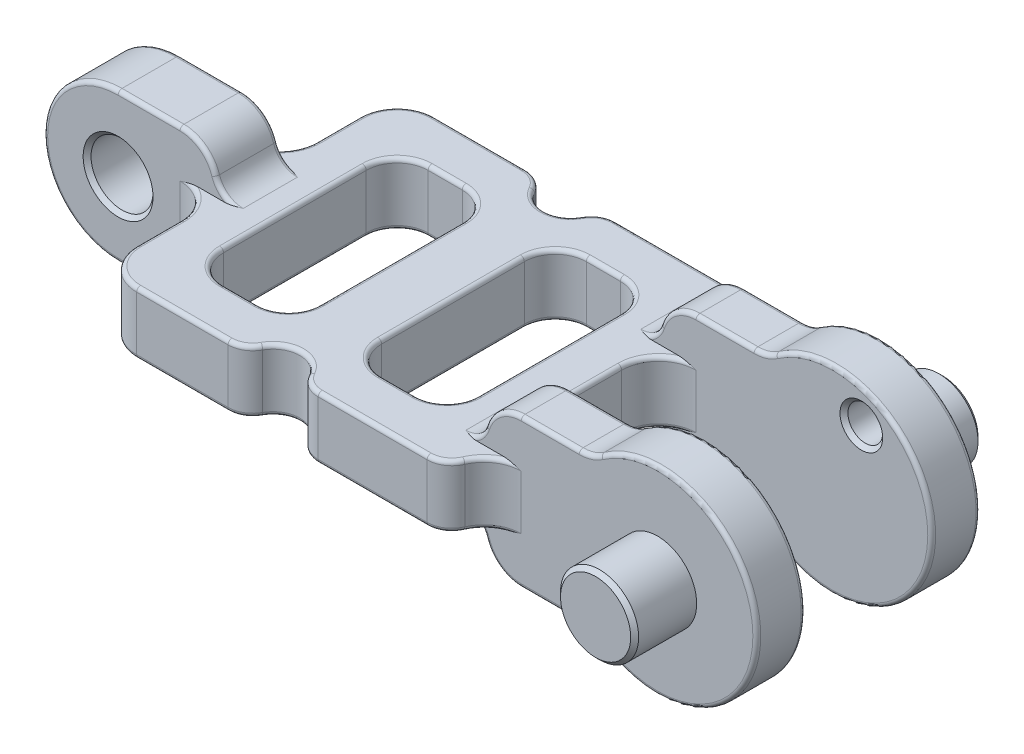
SolidWorks part; units mm, degrees
ref_plane "Front Plane" through (0, 0, 0) normal (0, 0, 1) x (1, 0, 0)
ref_plane "Top Plane" through (0, 0, 0) normal (0, 1, 0) x (1, 0, 0)
ref_plane "Right Plane" through (0, 0, 0) normal (1, 0, 0) x (0, 0, -1)
sketch "Sketch2" plane through (0, 0, 0) normal (0, 0, 1) x (1, 0, 0)
  line L0 (0, 0) -> (-63.5, 0) construction
  line L1 (-6.7202, 7.62) -> (-63.5, 7.62)
  line L2 (-6.7202, -7.62) -> (-63.5, -7.62)
  arc A0 (-6.7202, -7.62) -> (-6.7202, 7.62) centre (0, 0) ccw
  arc A1 (-63.5, 7.62) -> (-63.5, -7.62) centre (-63.5, 0) ccw
  circle A2 centre (-63.5, 0) radius 3.175
  dimension "D1" = 10.16
  dimension "D2" = 7.62
  dimension "D3" = 6.35
  dimension "D4" = 63.5
extrude "Boss-Extrude1" add sketch "Sketch2" along normal mid plane 30.48
sketch "Sketch3" plane through (0, 0, 0) normal (0, 1, 0) x (1, 0, 0)
  line L0 (0, 0) -> (-71.12, 0) construction
  line L1 (-71.12, 15.24) -> (-71.12, -15.24) construction
  line L2 (10.16, -15.24) -> (10.16, 15.24) construction
  line L3 (10.16, 6.477) -> (-17.78, 6.477)
  line L4 (10.16, 6.477) -> (10.16, -6.477)
  line L5 (10.16, -6.477) -> (-17.78, -6.477)
  line L6 (-17.78, 6.477) -> (-17.78, -6.477)
  line L8 (-6.7202, 15.24) -> (-63.5, 15.24) construction
  line L9 (-71.12, 3.175) -> (-53.34, 3.175)
  line L10 (-71.12, 3.175) -> (-71.12, 15.24)
  line L11 (-71.12, 15.24) -> (-53.34, 15.24)
  line L12 (-53.34, 3.175) -> (-53.34, 15.24)
  line L13 (-53.34, -3.175) -> (-53.34, -15.24)
  line L14 (-71.12, -15.24) -> (-53.34, -15.24)
  line L15 (-71.12, -3.175) -> (-71.12, -15.24)
  line L16 (-71.12, -3.175) -> (-53.34, -3.175)
  line L17 (-38.735, 7.3025) -> (-38.735, -7.3025)
  line L18 (-45.4025, 10.4775) -> (-41.91, 10.4775)
  line L19 (-48.5775, 7.3025) -> (-48.5775, -7.3025)
  line L20 (-45.4025, -10.4775) -> (-41.91, -10.4775)
  line L21 (-22.5425, 7.3025) -> (-22.5425, -7.3025)
  line L22 (-32.385, 7.3025) -> (-32.385, -7.3025)
  line L23 (-6.7202, -15.24) -> (-63.5, -15.24) construction
  line L24 (-17.78, -15.24) -> (10.16, -15.24)
  line L25 (-17.78, -15.24) -> (-17.78, -11.43)
  line L26 (-17.78, -11.43) -> (10.16, -11.43)
  line L27 (10.16, -15.24) -> (10.16, -11.43)
  line L28 (10.16, 15.24) -> (10.16, 11.43)
  line L29 (-17.78, 11.43) -> (10.16, 11.43)
  line L30 (-17.78, 15.24) -> (-17.78, 11.43)
  line L31 (-17.78, 15.24) -> (10.16, 15.24)
  line L32 (-29.21, 10.4775) -> (-25.7175, 10.4775)
  line L33 (-29.21, -10.4775) -> (-25.7175, -10.4775)
  line L34 (-41.91, 10.4775) -> (-29.21, 10.4775) construction
  line L35 (-35.56, 10.4775) -> (-35.56, 15.24) construction
  arc A0 (-25.7175, -10.4775) -> (-22.5425, -7.3025) centre (-25.7175, -7.3025) ccw
  arc A1 (-25.7175, 10.4775) -> (-22.5425, 7.3025) centre (-25.7175, 7.3025) cw
  arc A2 (-45.4025, 10.4775) -> (-48.5775, 7.3025) centre (-45.4025, 7.3025) ccw
  arc A3 (-48.5775, -7.3025) -> (-45.4025, -10.4775) centre (-45.4025, -7.3025) ccw
  arc A4 (-32.385, -7.3025) -> (-29.21, -10.4775) centre (-29.21, -7.3025) ccw
  arc A5 (-32.385, 7.3025) -> (-29.21, 10.4775) centre (-29.21, 7.3025) cw
  arc A6 (-38.735, -7.3025) -> (-41.91, -10.4775) centre (-41.91, -7.3025) cw
  arc A7 (-38.735, 7.3025) -> (-41.91, 10.4775) centre (-41.91, 7.3025) ccw
  circle A8 centre (-35.56, 15.24) radius 2.7305
  circle A9 centre (-35.56, -15.24) radius 2.7305
  point P44 (-7.62, 0)
  point P50 (-32.385, -10.4775)
  point P51 (-7.62, 0)
  point P54 (-32.385, 10.4775)
  point P58 (-10.795, 0)
  point P65 (-10.795, 0)
  point P72 (-10.795, 0)
  point P79 (-10.795, 0)
  point P86 (-10.795, 0)
  point P93 (-10.795, 0)
  point P100 (-7.62, 0)
  point P107 (-7.62, 0)
  point P114 (-8.89, 0)
  point P121 (-8.89, 0)
  point P128 (-13.97, 0)
  point P135 (-13.97, 0)
  point P142 (-13.97, 0)
  point P149 (-13.97, 0)
  point P156 (-13.97, 0)
  point P163 (-13.97, 0)
  point P170 (-13.97, 0)
  point P177 (-13.97, 0)
  point P184 (-13.97, 0)
  point P191 (-13.97, 0)
  point P198 (-15.24, 0)
  point P205 (-15.24, 0)
  point P212 (-15.24, 0)
  point P219 (-15.24, 0)
  point P226 (-17.78, 0)
  point P233 (-17.78, 0)
  point P240 (-17.145, 0)
  point P247 (-17.145, 0)
  point P254 (-15.24, 0)
  point P261 (-15.24, 0)
  point P268 (-15.24, 0)
  point P275 (-15.24, 0)
  point P282 (-15.24, 0)
  point P289 (-15.24, 0)
  dimension "D6" = 4.7625
  dimension "D9" = 3.175
  dimension "D11" = 3.175
  dimension "D13" = 5.461
  dimension "D1" = 12.954
  dimension "D2" = 17.78
  dimension "D3" = 6.35
  dimension "D4" = 27.94
  dimension "D5" = 4.7625
  dimension "D8" = 4.7625
  dimension "D10" = 3.81
  dimension "D7" = 4.7625
  dimension "D12" = 6.35
extrude "Cut-Extrude1" cut sketch "Sketch3" against normal through all and the other way through all
sketch "Sketch7" plane through (0, 0, 0) normal (0, 0, 1) x (1, 0, 0)
  line L0 (0, 0) -> (-63.5, 0) construction
  line L1 (-17.78, -7.62) -> (-17.78, 7.62) construction
  line L2 (-53.34, 7.62) -> (-17.78, 7.62)
  line L3 (-53.34, 7.62) -> (-53.34, 3.175)
  line L4 (-53.34, 3.175) -> (-17.78, 3.175)
  line L5 (-17.78, 7.62) -> (-17.78, 3.175)
  line L6 (-17.78, -7.62) -> (-17.78, -3.175)
  line L7 (-53.34, -3.175) -> (-17.78, -3.175)
  line L8 (-53.34, -7.62) -> (-53.34, -3.175)
  line L9 (-53.34, -7.62) -> (-17.78, -7.62)
  dimension "D1" = 4.445
extrude "Cut-Extrude3" cut sketch "Sketch7" against normal through all and the other way through all
fillet "Fillet2" radius 3.81 18 edges at (-6.7202, -7.62, -8.9535) (-6.7202, -7.62, 8.9535) (-6.7202, 7.62, -8.9535) (-6.7202, 7.62, 8.9535) (-17.78, 0, 6.477) (-17.78, 0, -6.477) (-53.34, 0, 15.24) (-53.34, 0, -15.24) (-53.34, 0, -3.175) (-53.34, 0, 3.175) (-17.78, 0, -11.43) (-17.78, 0, 11.43) (-17.78, -7.62, -8.9535) (-17.78, -7.62, 8.9535) (-53.34, -7.62, 0) (-53.34, 7.62, 0) (-17.78, 7.62, 8.9535) (-17.78, 7.62, -8.9535)
fillet "Fillet3" radius 2.54 12 edges at (-17.78, 0, -15.24) (-17.78, 0, 15.24) (-32.8295, 0, -15.24) (-38.2905, 0, -15.24) (-38.2905, 0, 15.24) (-32.8295, 0, 15.24) (-17.78, -3.175, -8.9535) (-17.78, -3.175, 8.9535) (-53.34, -3.175, 0) (-17.78, 3.175, 8.9535) (-17.78, 3.175, -8.9535) (-53.34, 3.175, 0)
sketch "Sketch4" plane through (0, 0, 11.43) normal (0, 0, 1) x (1, 0, 0)
  circle A0 centre (0, 0) radius 4.0005
  dimension "D1" = 8.001
extrude "Boss-Extrude2" add sketch "Sketch4" along normal blind 6.35
mirror "Mirror1" about plane through (0, 0, 0) normal (0, 0, 1) of "Boss-Extrude2"
fillet "Fillet4" radius 0.4064 71 edges at (-11.0011, -7.62, 6.477) (-6.8834, 7.7973, -6.477) (-11.0011, 7.62, -11.43) (-6.8834, 7.7973, -11.43) (10.16, 0, -11.43) (-11.0011, -7.62, -11.43) (-60.325, -7.62, 3.175) (-11.0011, -7.62, 11.43) (-6.8834, -7.7973, 11.43) (-11.0011, 7.62, 11.43) (-60.325, 7.62, 3.175) (-54.896, 6.8817, -3.175) (-54.896, -6.8817, 3.175) (-54.896, 6.8817, 3.175) (-16.224, -6.8817, 6.477) (-16.224, 6.8817, 6.477) (-16.224, -6.8817, -11.43) (-16.224, 6.8817, -11.43) (-16.224, -6.8817, 11.43) (-16.224, 6.8817, 11.43) (-18.3987, -3.175, -14.8251) (-25.3659, -3.175, -15.24) (-32.2347, -3.175, -14.8864) (-35.56, -3.175, -12.5095) (-38.8853, -3.175, -14.8864) (-54.4559, -3.175, -4.2909) (-52.2241, -3.175, -14.1241) (-23.4724, -3.175, -9.5476) (-27.4638, -3.175, -10.4775) (-31.4551, -3.175, -9.5476) (-32.385, -3.175, 0) (-27.4638, -3.175, 10.4775) (-23.4724, -3.175, 9.5476) (-22.5425, 3.175, 0) (-32.385, 3.175, 0) (-31.4551, 3.175, -9.5476) (-39.6649, 3.175, -9.5476) (-39.6649, 3.175, 9.5476) (-47.6476, 3.175, -9.5476) (-47.6476, -3.175, -9.5476) (-43.6562, -3.175, 10.4775) (-39.6649, -3.175, 9.5476) (-54.4559, 3.175, -4.2909) (-16.0568, 3.175, -12.0523) (-25.3659, 3.175, -15.24) (-16.0568, -3.175, 12.0523) (-18.3987, -3.175, 14.8251) (-35.56, -3.175, 12.5095) (-44.854, -3.175, 15.24) (-54.4559, -3.175, 4.2909) (-53.34, -3.175, 9.2075) (-53.34, 3.175, 9.2075) (-18.3987, 3.175, 14.8251) (-25.3659, 3.175, 15.24) (-32.2347, 3.175, 14.8864) (-35.56, 3.175, 12.5095) (-38.8853, 3.175, 14.8864) (-44.854, 3.175, 15.24) (-44.854, -3.175, -15.24) (-22.5425, -3.175, 0) (-43.6562, 3.175, -10.4775) (-44.854, 3.175, -15.24) (-18.5248, -3.6672, 6.477) (-18.5248, 3.6672, 6.477) (-18.5248, 3.6672, -11.43) (-18.5248, 3.6672, -6.477) (-18.5248, -3.6672, -6.477) (-52.5952, -3.6672, 3.175) (-16.6641, -3.175, -5.3611) (-16.6641, -3.175, 5.3611) (-17.78, -3.175, 0)
sketch "Sketch6" plane through (0, 0, 0) normal (0, 0, 1) x (1, 0, 0)
  line L0 (0, 0) -> (2.952, 6.3306) construction
  line L1 (0, 0) -> (0, 6.985) construction
  circle A0 centre (2.952, 6.3306) radius 1.778
  circle A1 centre (0, 0) radius 6.985 construction
  dimension "D1" = 3.556
  dimension "D2" = 13.97
  dimension "D3" = 25
extrude "Cut-Extrude2" cut sketch "Sketch6" against normal mid plane 19.05
chamfer "Chamfer1" distance 0.4064 angle 45 6 edges at (4.0005, 0, -17.78) (4.0005, 0, 17.78) (-60.325, 0, -3.175) (-66.675, 0, 3.175) (4.73, 6.3306, 6.477) (1.174, 6.3306, -6.477)
